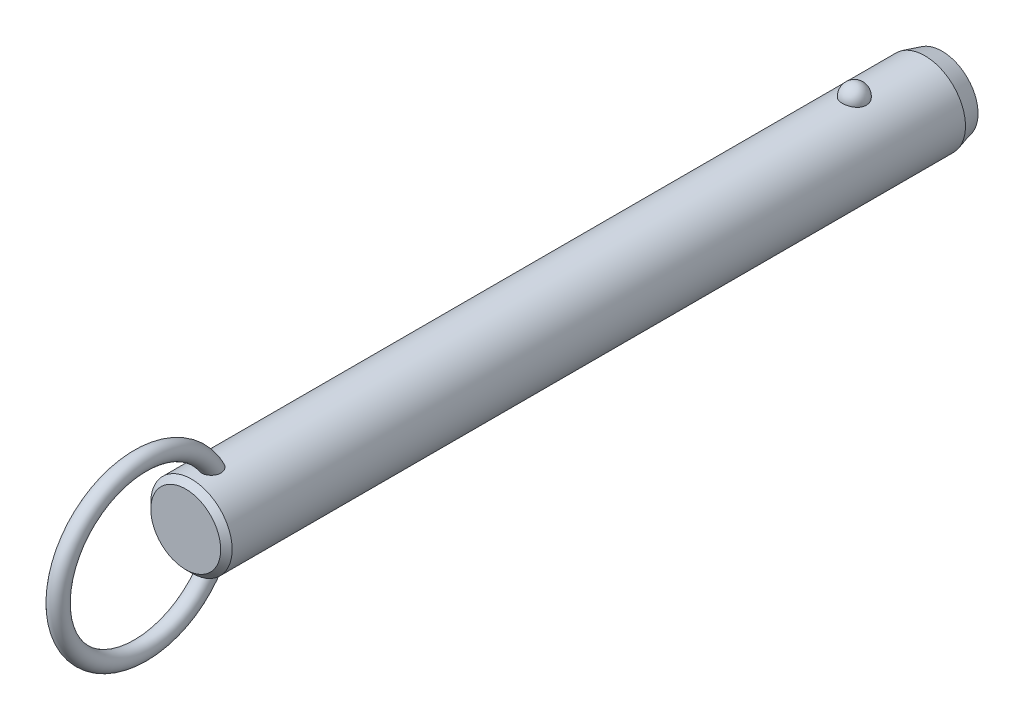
SolidWorks part; units mm, degrees
ref_plane "Front Plane" through (0, 0, 0) normal (0, 0, 1) x (1, 0, 0)
ref_plane "Top Plane" through (0, 0, 0) normal (0, 1, 0) x (1, 0, 0)
ref_plane "Right Plane" through (0, 0, 0) normal (1, 0, 0) x (0, 0, -1)
sketch "Sketch2" plane through (0, 0, 0) normal (0, 0, 1) x (1, 0, 0)
  circle A0 centre (0, 0) radius 7.1
  point P3 (0, 7.1)
  dimension "D1" = 14.2
extrude "Boss-Extrude1" add sketch "Sketch2" along normal blind 106.7
sketch "Sketch3" plane through (0, 0, 0) normal (0, 0, -1) x (-1, 0, 0)
  circle A0 centre (0, 0) radius 7.1
  dimension "D1" = 14.2
extrude "Boss-Extrude2" add sketch "Sketch3" along normal blind 17.4
chamfer "Chamfer1" distance 3 angle 15 1 edges at (-7.1, 0, -17.4)
sketch "Sketch12" plane through (0, 0, 0) normal (1, 0, 0) x (0, 0, -1)
  line L0 (-106.7, 7.1) -> (-106.7, -7.1) construction
  point P0 (-106.7, 0)
sketch "Sketch13" plane through (0, 0, 0) normal (1, 0, 0) x (0, 0, -1)
  circle A0 centre (-122.55, 0) radius 15.85
  point P2 (-106.7, 0)
  dimension "D1" = 31.7
sketch "Sketch14" plane through (0, 0, 0) normal (0, 1, 0) x (1, 0, 0)
  circle A0 centre (0, -108.2) radius 1.5
  point P2 (0, -106.7)
  dimension "D1" = 3
sweep "Sweep1" add profiles "Sketch14" path "Sketch13"
sketch "Sketch15" plane through (0, 0, 106.7) normal (0, 0, 1) x (1, 0, 0)
  circle A0 centre (0, 0) radius 7.1
  dimension "D1" = 14.2
extrude "Boss-Extrude3" add sketch "Sketch15" along normal blind 7.92
chamfer "Chamfer2" distance 1 angle 45 1 edges at (7.1, 0, 114.62)
sketch "Sketch18" plane through (0, 0, 0) normal (1, 0, 0) x (0, 0, -1)
  line L0 (14.4, 7.1) -> (-108.3792, 7.1) construction
  line L1 (2.1, 9.2) -> (2.1, 5)
  line L2 (-108.3792, -7.1) -> (14.4, -7.1) construction
  arc A0 (2.1, 9.2) -> (2.1, 5) centre (2.1, 7.1) ccw
  point P4 (0, 7.1)
  dimension "D1" = 16.3
revolve "Revolve1" add sketch "Sketch18" angle 360 about L1
